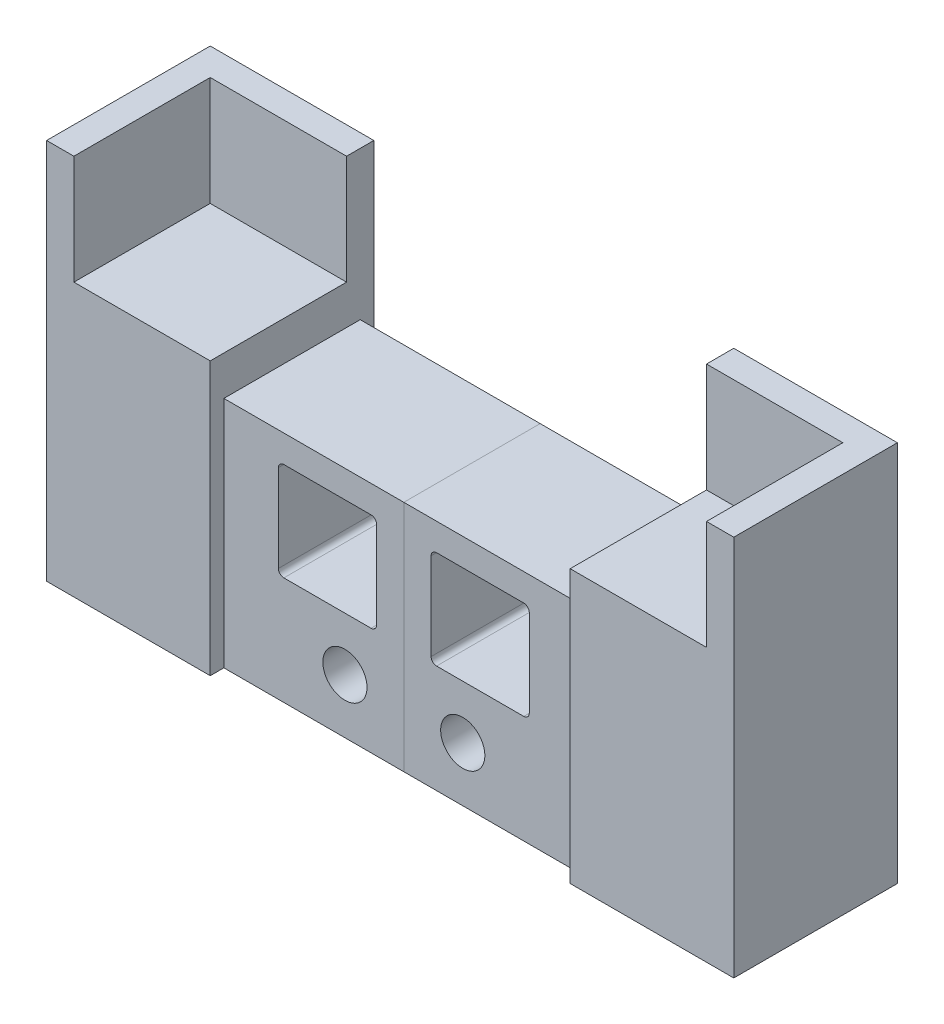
SolidWorks part; units mm, degrees
ref_plane "Alzado" through (0, 0, 0) normal (0, 0, 1) x (1, 0, 0)
ref_plane "Planta" through (0, 0, 0) normal (0, 1, 0) x (1, 0, 0)
ref_plane "Vista lateral" through (0, 0, 0) normal (1, 0, 0) x (0, 0, -1)
sketch "Croquis1" plane through (0, 0, 0) normal (0, 1, 0) x (1, 0, 0)
  line L1 (-15, -15) -> (15, -15)
  line L2 (-15, -15) -> (-15, 15)
  line L3 (-15, 15) -> (15, 15)
  line L4 (15, -15) -> (15, 15)
  line L5 (-15, -15) -> (15, 15) construction
  line L6 (-15, 15) -> (15, -15) construction
  point P0 (0, 0)
  dimension "D1" = 30
  dimension "D2" = 30
extrude "Saliente-Extruir1" add sketch "Croquis1" along normal blind 50
sketch "Croquis2" plane through (0, 0, 0) normal (0, -1, 0) x (1, 0, 0)
  line L1 (-10, -10) -> (10, -10)
  line L2 (-10, -10) -> (-10, 10)
  line L3 (-10, 10) -> (10, 10)
  line L4 (10, -10) -> (10, 10)
  line L5 (-10, -10) -> (10, 10) construction
  line L6 (-10, 10) -> (10, -10) construction
  point P0 (0, 0)
  dimension "D1" = 20
  dimension "D2" = 20
extrude "Cortar-Extruir1" cut sketch "Croquis2" against normal offset from surface (45 mm away) 5
sketch "Croquis3" plane through (0, 0, 0) normal (0, 0, 1) x (1, 0, 0)
  line L0 (15, 50) -> (15, 0) construction
  line L2 (15, 42.79) -> (15, 0)
  line L4 (25, 37.79) -> (25, 19.79)
  line L5 (-15, 50) -> (15, 50) construction
  line L6 (48, 28.79) -> (17.5282, 28.79) construction
  line L8 (48, 42.79) -> (48, 0)
  line L10 (43, 37.79) -> (43, 19.79)
  line L13 (25, 37.79) -> (43, 37.79)
  line L17 (25, 19.79) -> (43, 19.79)
  line L19 (48, 0) -> (15, 0)
  line L20 (15, 10) -> (37.2, 10) construction
  line L21 (37.2, 0) -> (37.2, 10) construction
  line L22 (15, 42.79) -> (48, 42.79)
  circle A0 centre (37.2, 10) radius 4.05
  point P8 (25, 28.79)
  dimension "D3" = 8.1
  dimension "D1" = 10
  dimension "D2" = 21.21
  dimension "D4" = 5
  dimension "D5" = 18
  dimension "D6" = 18
  dimension "D7" = 10
  dimension "D8" = 5
  dimension "D9" = 22.2
extrude "Saliente-Extruir2" add sketch "Croquis3" along normal blind 12.5 and the other way blind 12.5
fillet "Redondeo2" radius 1 4 edges at (43, 19.79, 0) (25, 19.79, 0) (25, 37.79, 0) (43, 37.79, 0)
sketch "Croquis5" plane through (0, 0, -12.5) normal (0, 0, -1) x (-1, 0, 0)
  line L0 (-48, 0) -> (-48, 42.79) construction
  line L1 (-15, 0) -> (-48, 0)
  line L2 (-15, 0) -> (-15, 15)
  line L3 (-15, 15) -> (-48, 15)
  line L4 (-48, 0) -> (-48, 15)
  dimension "D1" = 15
extrude "Saliente-Extruir3" add sketch "Croquis5" against normal offset from surface (7.5 mm away) 10 from offset 10 contours L3 L4 L1 L2
sketch "Croquis6" plane through (48, 0, 0) normal (1, 0, 0) x (0, 0, -1)
  line L0 (0, 0) -> (0, 28.8) construction
  line L1 (0, 28.8) -> (12.5, 28.8) construction
  line L2 (12.5, 42.79) -> (12.5, 0) construction
  line L4 (-15, 50) -> (15, 50) construction
  circle A0 centre (0, 28.8) radius 2
  dimension "D1" = 4
  dimension "D2" = 21.2
extrude "Cortar-Extruir3" cut sketch "Croquis6" against normal offset from surface (28 mm away) 5
sketch "Croquis7" plane through (0, 50, 0) normal (0, 1, 0) x (1, 0, 0)
  line L0 (15, 15) -> (15, 10)
  line L1 (15, -15) -> (15, 15) construction
  line L2 (15, 10) -> (-10, 10)
  line L3 (-10, 10) -> (-10, -15)
  line L4 (-15, -15) -> (15, -15) construction
  line L5 (-10, -15) -> (-15, -15)
  line L6 (15, 15) -> (-15, 15) construction
  line L7 (-15, 15) -> (-15, -15) construction
  line L8 (15, 15) -> (-15, 15)
  line L9 (-15, 15) -> (-15, -15)
  dimension "D1" = 5
  dimension "D2" = 5
extrude "Saliente-Extruir4" add sketch "Croquis7" along normal blind 20
mirror "Simetría1" about plane through (48, 42.79, -12.5) normal (1, 0, 0)
